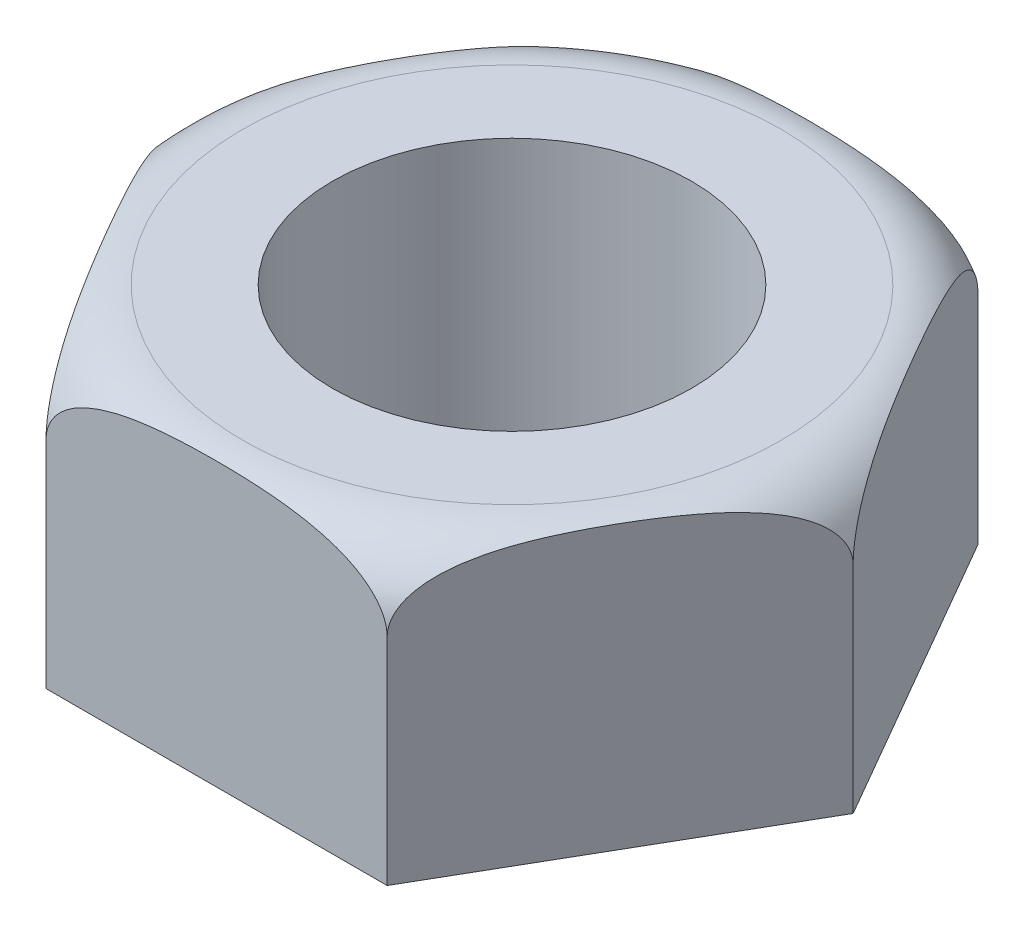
SolidWorks part; units mm, degrees
ref_plane "Front" through (0, 0, 0) normal (0, 0, 1) x (1, 0, 0)
ref_plane "Top" through (0, 0, 0) normal (0, 1, 0) x (1, 0, 0)
ref_plane "Right" through (0, 0, 0) normal (1, 0, 0) x (0, 0, -1)
sketch "Sketch1" plane through (0, 0, 0) normal (0, 1, 0) x (1, 0, 0)
  line L1 (9.5, 0) -> (4.75, 8.2272)
  line L2 (4.75, 8.2272) -> (-4.75, 8.2272)
  line L3 (-4.75, 8.2272) -> (-9.5, 0)
  line L4 (-9.5, 0) -> (-4.75, -8.2272)
  line L5 (-4.75, -8.2272) -> (4.75, -8.2272)
  line L6 (4.75, -8.2272) -> (9.5, 0)
  circle A0 centre (0, 0) radius 8.2272 construction
  circle A1 centre (0, 0) radius 5
  dimension "D2" = 10
  dimension "D1" = 19
extrude "Extrude1" add sketch "Sketch1" along normal blind 8
sketch "Sketch2" plane through (0, 0, 0) normal (0, 0, 1) x (1, 0, 0)
  line L1 (4.75, 8) -> (9.5, 8) construction
  line L2 (0, -2.3173) -> (0, 9.6237) construction
  line L3 (4.75, 8) -> (7.5, 8)
  line L4 (9.5, 6) -> (10.9389, 6)
  line L5 (10.9389, 6) -> (10.9389, 9.6237)
  line L6 (10.9389, 9.6237) -> (4.75, 9.6237)
  line L7 (4.75, 9.6237) -> (4.75, 8)
  line L8 (9.5, 8) -> (9.5, 0) construction
  arc A0 (9.5, 6) -> (7.5, 8) centre (7.5, 6) ccw
  dimension "D1" = 2
revolve "Cut-Revolve1" cut sketch "Sketch2" angle 360 about L2
